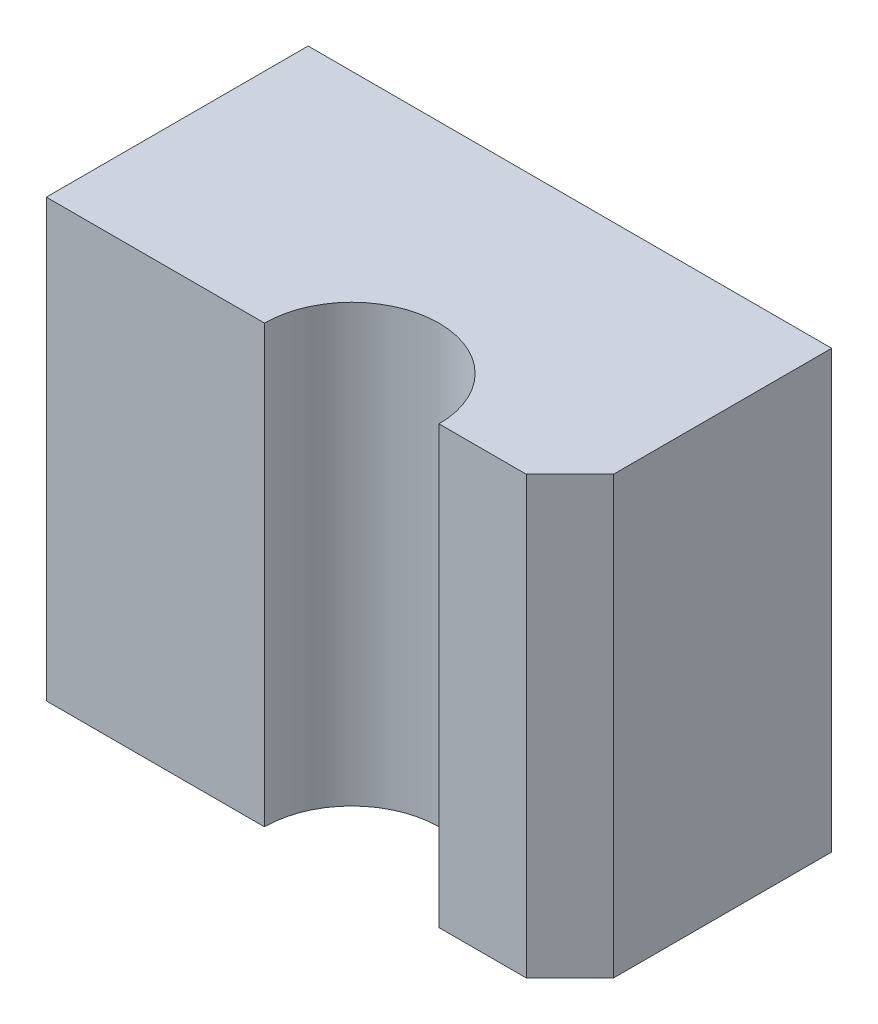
SolidWorks part; units mm, degrees
ref_plane "正面" through (0, 0, 0) normal (0, 0, 1) x (1, 0, 0)
ref_plane "平面" through (0, 0, 0) normal (0, 1, 0) x (1, 0, 0)
ref_plane "右側面" through (0, 0, 0) normal (1, 0, 0) x (0, 0, -1)
sketch "ｽｹｯﾁ2" plane through (0, 0, 0) normal (0, 0, 1) x (1, 0, 0)
  line L1 (0, 0) -> (120, 0)
  line L2 (0, 0) -> (0, 100)
  line L3 (0, 100) -> (120, 100)
  line L4 (120, 0) -> (120, 100)
  dimension "D1" = 100
  dimension "D2" = 120
extrude "ﾎﾞｽ - 押し出し1" add sketch "ｽｹｯﾁ2" along normal blind 60
sketch "ｽｹｯﾁ3" plane through (0, 0, 0) normal (0, -1, 0) x (1, 0, 0)
  line L0 (0, 60) -> (120, 60) construction
  line L1 (120, 60) -> (120, 0) construction
  circle A0 centre (70, 60) radius 20
  dimension "D2" = 40
  dimension "D1" = 50
extrude "ｶｯﾄ - 押し出し1" cut sketch "ｽｹｯﾁ3" against normal through all
chamfer "面取り1" distance 10 angle 45 1 edges at (120, 50, 60)
